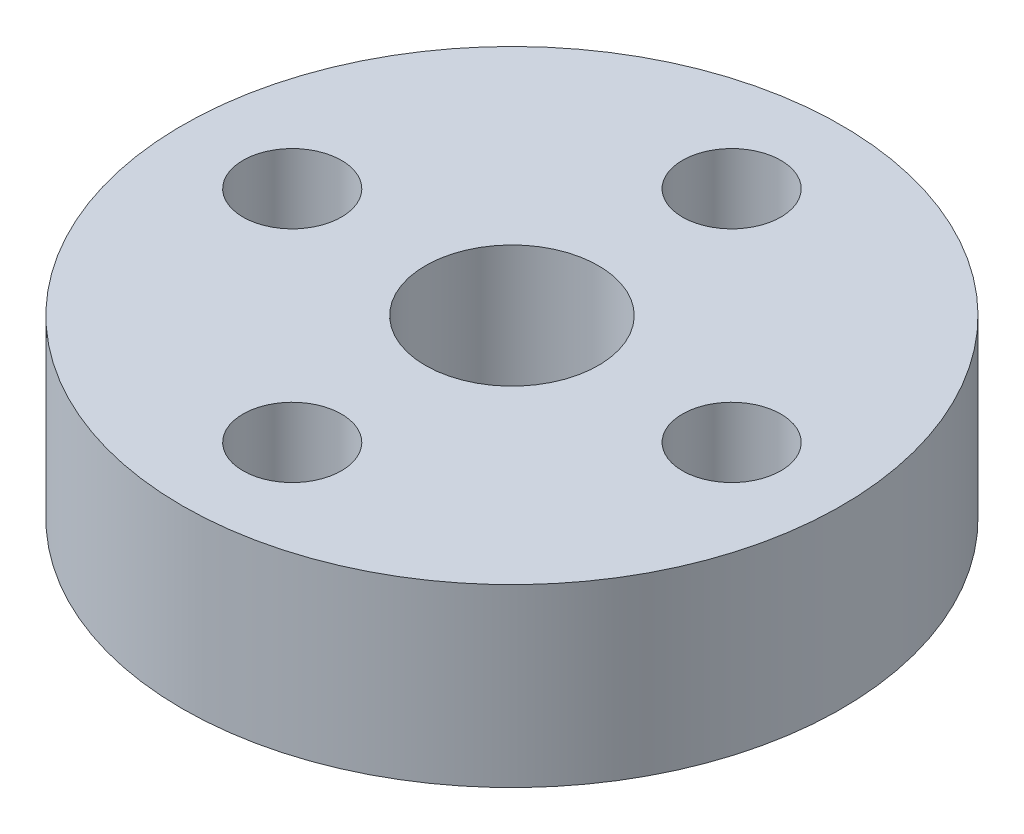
SolidWorks part; units mm, degrees
ref_plane "Front Plane" through (0, 0, 0) normal (0, 0, 1) x (1, 0, 0)
ref_plane "Top Plane" through (0, 0, 0) normal (0, 1, 0) x (1, 0, 0)
ref_plane "Right Plane" through (0, 0, 0) normal (1, 0, 0) x (0, 0, -1)
sketch "Sketch1" plane through (0, 0, 0) normal (0, 1, 0) x (1, 0, 0)
  circle A0 centre (0, 0) radius 9.525
  circle A1 centre (0, 0) radius 2.5
  dimension "D1" = 5
  dimension "D2" = 19.05
extrude "Boss-Extrude1" add sketch "Sketch1" along normal blind 5.08
hole_wizard "#34 (0.111) Diameter Hole1" positions "Sketch7" profile "Sketch5" hole size "#34" standard "ANSI Inch"
sketch "Sketch7" plane through (0, 5.08, 0) normal (0, 1, 0) x (1, 0, 0)
  point P0 (-6.35, 0)
  point P4 (0, 6.35)
  point P7 (6.35, 0)
  point P10 (0, -6.35)
  dimension "D1" = 6.35
  dimension "D2" = 6.35
  dimension "D3" = 6.35
  dimension "D4" = 6.35
sketch "Sketch5" plane through (-6.35, 5.08, 0) normal (1, 0, 0) x (0, 0, 1)
  line L0 (0, 0) -> (0, 5.08)
  line L1 (0, 5.08) -> (1.4224, 5.08)
  line L2 (1.4224, 5.08) -> (1.4224, 0)
  line L5 (1.4224, 0) -> (0, 0)
  line L11 (0, -6.35) -> (0, 107.95) construction
  dimension "Thru Hole Dia." = 2.8448
  dimension "Thru Hole Depth" = 5.08
